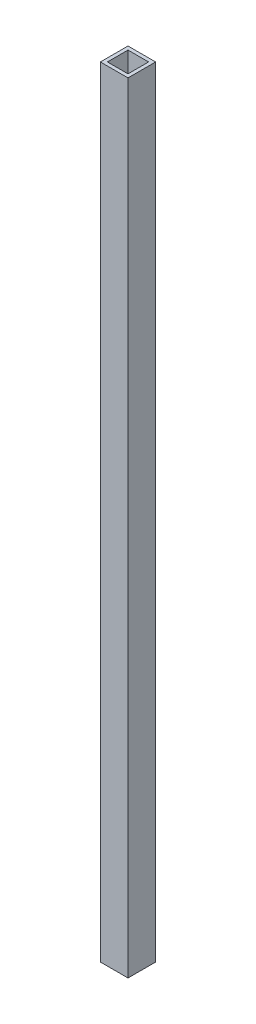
SolidWorks part; units mm, degrees
ref_plane "Front Plane" through (0, 0, 0) normal (0, 0, 1) x (1, 0, 0)
ref_plane "Top Plane" through (0, 0, 0) normal (0, 1, 0) x (1, 0, 0)
ref_plane "Right Plane" through (0, 0, 0) normal (1, 0, 0) x (0, 0, -1)
sketch "Sketch1" plane through (0, 0, 0) normal (0, 1, 0) x (1, 0, 0)
  line L0 (6.3, 12.6) -> (6.3, 11) construction
  line L1 (0, 0) -> (12.6, 0)
  line L2 (0, 0) -> (0, 12.6)
  line L3 (0, 12.6) -> (12.6, 12.6)
  line L4 (12.6, 0) -> (12.6, 12.6)
  line L5 (1.6, 1.6) -> (11, 1.6)
  line L6 (1.6, 1.6) -> (1.6, 11)
  line L7 (1.6, 11) -> (11, 11)
  line L8 (11, 1.6) -> (11, 11)
  line L9 (11, 6.3) -> (12.6, 6.3) construction
  dimension "D1" = 12.6
  dimension "D2" = 1.6
extrude "Boss-Extrude1" add sketch "Sketch1" along normal blind 355.6
